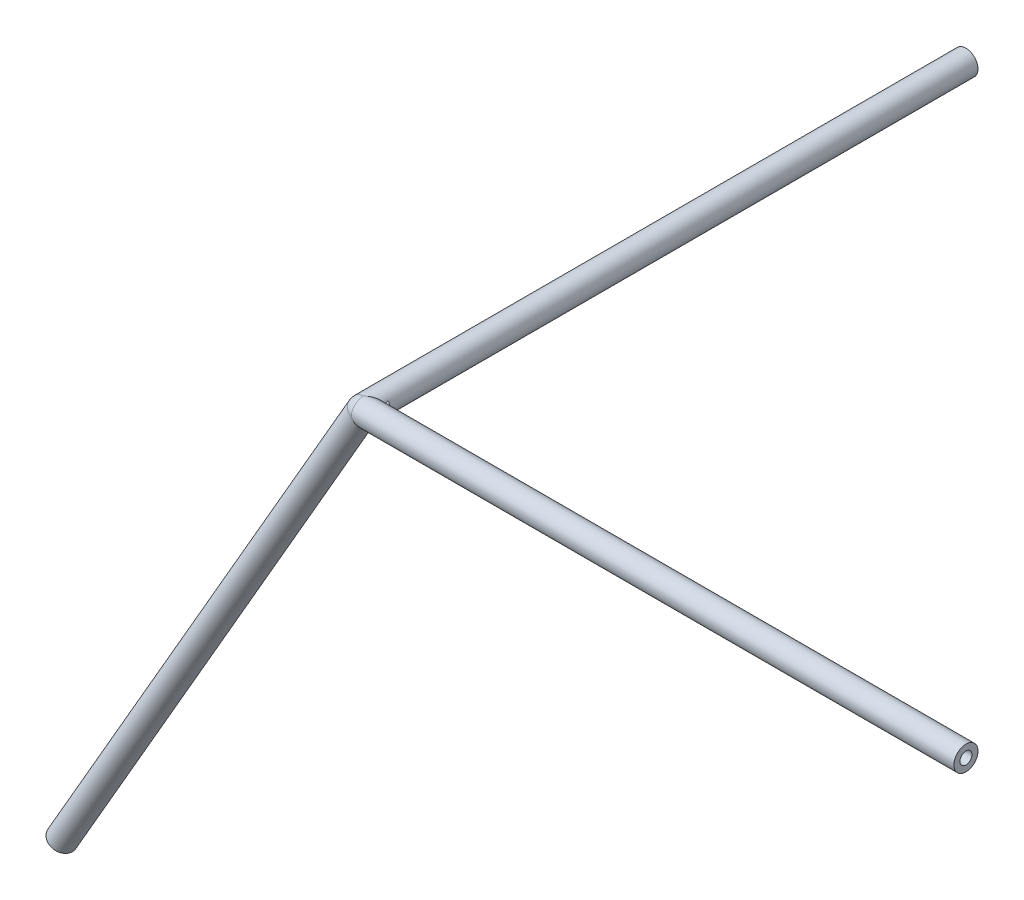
SolidWorks part; units mm, degrees
ref_plane "Front Plane" through (0, 0, 0) normal (0, 0, 1) x (1, 0, 0)
ref_plane "Top Plane" through (0, 0, 0) normal (0, 1, 0) x (1, 0, 0)
ref_plane "Right Plane" through (0, 0, 0) normal (1, 0, 0) x (0, 0, -1)
sketch "Sketch1" plane through (0, 0, 0) normal (0, 0, 1) x (1, 0, 0)
  line L0 (0, 0) -> (500, 0)
  dimension "D1" = 500
sketch "Sketch2" plane through (0, 0, 0) normal (0, 0, 1) x (1, 0, 0)
  line L0 (0, 0) -> (-250, -433.0127)
  line L1 (0, 0) -> (500, 0) construction
  dimension "D1" = 500
  dimension "D2" = 120
sketch "Sketch3" plane through (0, 0, 0) normal (0, 1, 0) x (1, 0, 0)
  line L0 (0, 0) -> (0, 500)
  dimension "D1" = 500
ref_plane "Plane1" through (0, 0, -500) normal (0, 0, 1) x (1, 0, 0)
ref_plane "Plane2" through (0, 0, 0) normal (-0.866, 0.5, 0) x (0, 0, 1)
sketch "Sketch4" plane through (0, 0, 0) normal (-0.866, 0.5, 0) x (0, 0, 1)
  line L0 (0, -50) -> (-50, -50) construction
  line L1 (0, 0) -> (0, -500) construction
ref_plane "Plane3" through (-250, -433.0127, 0) normal (-0.5, -0.866, 0) x (-0.866, 0.5, 0)
ref_plane "Plane4" through (500, 0, 0) normal (1, 0, 0) x (0, 0, -1)
sketch "Sketch5" plane through (-250, -433.0127, 0) normal (-0.5, -0.866, 0) x (-0.866, 0.5, 0)
  circle A0 centre (0, 0) radius 10
  dimension "D1" = 20
sketch "Sketch6" plane through (0, 0, -500) normal (0, 0, 1) x (1, 0, 0)
  circle A0 centre (0, 0) radius 10
  dimension "D1" = 20
sketch "Sketch7" plane through (500, 0, 0) normal (1, 0, 0) x (0, 0, -1)
  circle A0 centre (0, 0) radius 10
  dimension "D1" = 20
sweep "Sweep1" add profiles "Sketch7" path "Sketch1"
sweep "Sweep2" add profiles "Sketch6" path "Sketch3"
sweep "Sweep3" add profiles "Sketch5" path "Sketch2"
surface "Surface-Sweep2"
surface "Surface-Knit7"
surface "Surface-Knit8"
sketch "Sketch11" plane through (0, 0, 0) normal (0, 1, 0) x (1, 0, 0)
  line L0 (0, 0) -> (8.3205, 12.4808)
  line L1 (0, 0) -> (27.8755, 0) construction
  line L2 (0, 0) -> (0, 16.9573) construction
  dimension "D1" = 15
  dimension "D2" = 56.31
sketch "Sketch12" plane through (0, 0, 0) normal (-0.866, 0.5, 0) x (0, 0, 1)
  line L0 (0, 0) -> (-12.4808, -8.3205)
  line L1 (0, 0) -> (55.1963, 0) construction
  line L2 (0, 0) -> (0, 20.9465) construction
  dimension "D1" = 33.69
  dimension "D2" = 15
ref_plane "Plane5" through (8.3205, 0, -12.4808) normal (0.5547, 0, -0.8321) x (-0.8321, 0, -0.5547)
ref_plane "Plane6" through (-4.1602, -7.2058, -12.4808) normal (-0.2773, -0.4804, -0.8321) x (-0.959, 0.1906, 0.2097)
sketch "Sketch13" plane through (8.3205, 0, -12.4808) normal (0.5547, 0, -0.8321) x (-0.8321, 0, -0.5547)
  circle A0 centre (0, 0) radius 5
  dimension "D1" = 10
sketch "Sketch14" plane through (-4.1602, -7.2058, -12.4808) normal (-0.2773, -0.4804, -0.8321) x (-0.959, 0.1906, 0.2097)
  circle A0 centre (0, 0) radius 5
  dimension "D1" = 10
sweep "Sweep4" add profiles "Sketch13" path "Sketch11"
sweep "Sweep5" add profiles "Sketch14" path "Sketch12"
shell "Shell1" thickness 5
